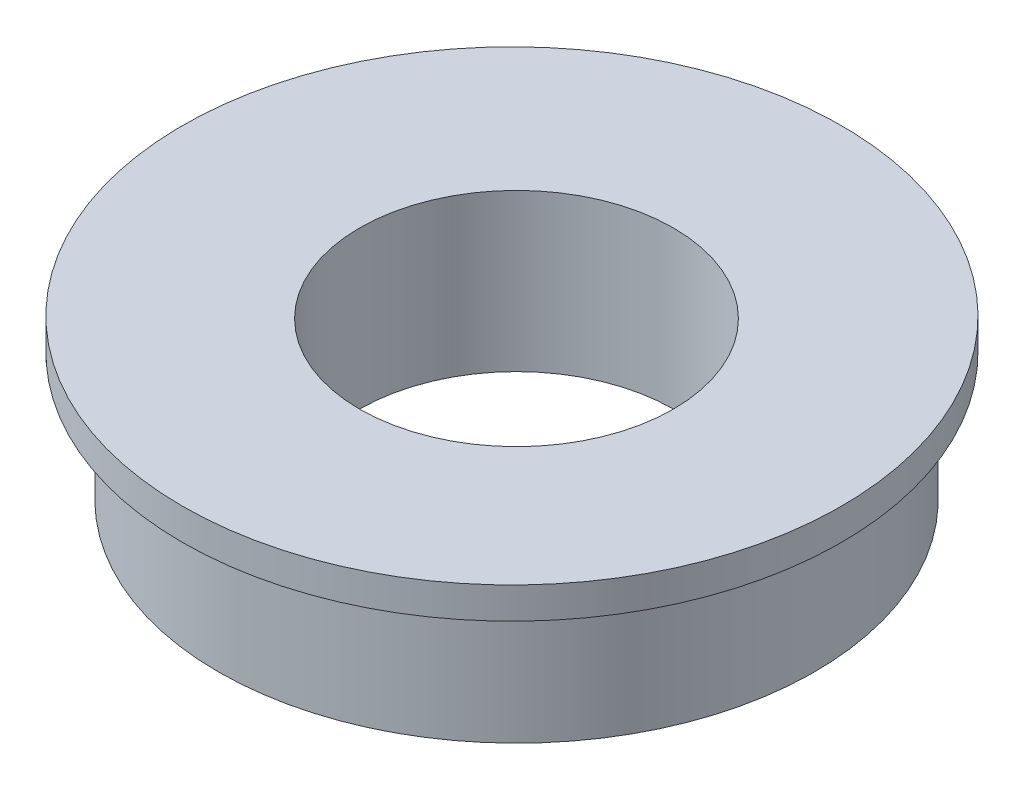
SolidWorks part; units mm, degrees
ref_plane "Front Plane" through (0, 0, 0) normal (0, 0, 1) x (1, 0, 0)
ref_plane "Top Plane" through (0, 0, 0) normal (0, 1, 0) x (1, 0, 0)
ref_plane "Right Plane" through (0, 0, 0) normal (1, 0, 0) x (0, 0, -1)
sketch "Sketch1" plane through (0, 0, 0) normal (0, 1, 0) x (1, 0, 0)
  circle A0 centre (0, 0) radius 9.5
  circle A1 centre (0, 0) radius 5
  dimension "D1" = 10
  dimension "D2" = 19
extrude "Boss-Extrude1" add sketch "Sketch1" along normal blind 5
sketch "Sketch2" plane through (0, 5, 0) normal (0, 1, 0) x (1, 0, 0)
  circle A0 centre (0, 0) radius 5
  circle A1 centre (-0.1453, 0) radius 10.5
  dimension "D1" = 21
extrude "Boss-Extrude2" add sketch "Sketch2" against normal blind 1
